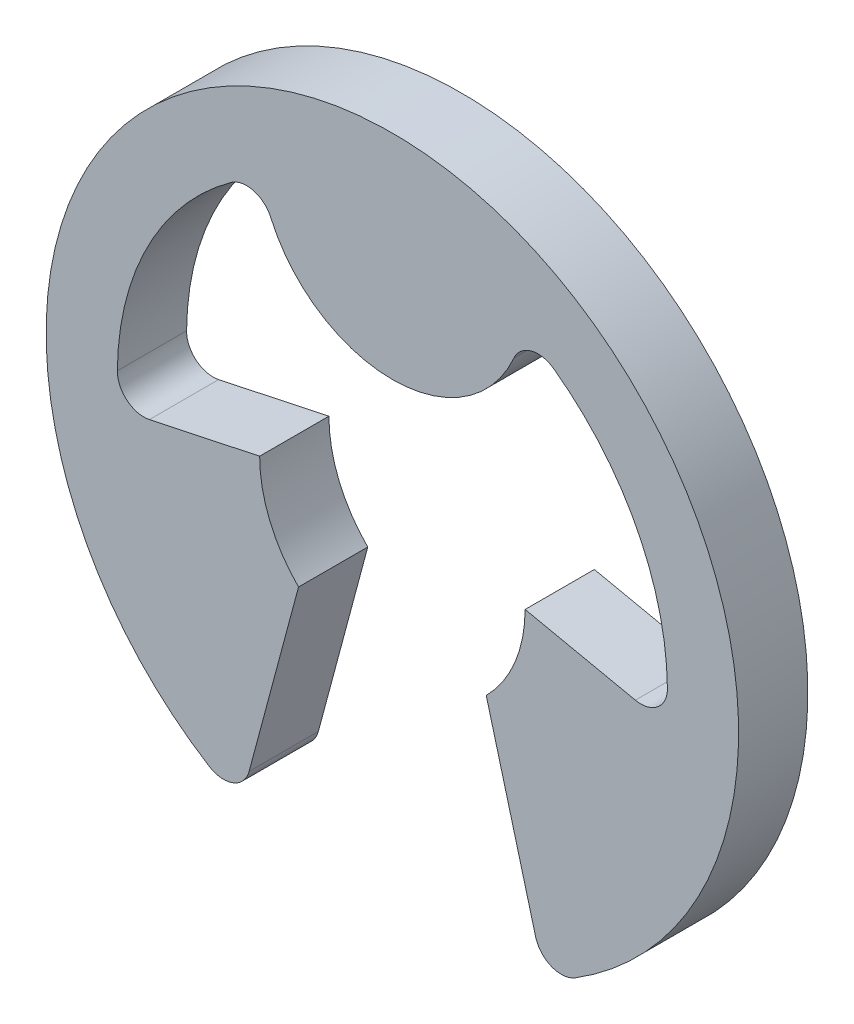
SolidWorks part; units mm, degrees
ref_plane "Face" through (0, 0, 0) normal (0, 0, 1) x (1, 0, 0)
ref_plane "Dessus" through (0, 0, 0) normal (0, 1, 0) x (1, 0, 0)
ref_plane "Droite" through (0, 0, 0) normal (1, 0, 0) x (0, 0, -1)
sketch "Esquisse1" plane through (0, 0, 0) normal (0, 0, 1) x (1, 0, 0)
  line L0 (0, 2.3) -> (0, -2.1213) construction
  line L1 (0.8132, -0.8132) -> (1.2414, -2.4113)
  line L2 (-2.1054, -0.2031) -> (-1.15, 0)
  line L3 (2.1054, -0.2031) -> (1.15, 0)
  line L5 (-0.8132, -0.8132) -> (-1.2414, -2.4113)
  line L6 (0, 0) -> (-3, 0) construction
  line L8 (0, 0) -> (-2.1213, -2.1213) construction
  arc A0 (-1.5851, -2.5471) -> (-1.2414, -2.4113) centre (-1.4636, -2.3518) ccw
  arc A1 (1.5851, -2.5471) -> (-1.5851, -2.5471) centre (0, 0) ccw
  arc A2 (-1.15, 0) -> (-0.8132, -0.8132) centre (0, 0) ccw
  arc A3 (-2.3832, 0.0242) -> (-2.1054, -0.2031) centre (-2.1532, 0.0219) ccw
  arc A4 (-1.3979, 1.9303) -> (-2.3832, 0.0242) centre (0, 0) ccw
  arc A5 (-1.0525, 1.8367) -> (-1.3979, 1.9303) centre (-1.263, 1.744) ccw
  arc A6 (1.0525, 1.8367) -> (1.3979, 1.9303) centre (1.263, 1.744) cw
  arc A7 (-1.0525, 1.8367) -> (1.0525, 1.8367) centre (0, 2.3) ccw
  arc A8 (1.3979, 1.9303) -> (2.3832, 0.0242) centre (0, 0) cw
  arc A9 (2.3832, 0.0242) -> (2.1054, -0.2031) centre (2.1532, 0.0219) cw
  arc A10 (1.15, 0) -> (0.8132, -0.8132) centre (0, 0) cw
  arc A11 (1.5851, -2.5471) -> (1.2414, -2.4113) centre (1.4636, -2.3518) cw
  dimension "D1" = 3
  dimension "D2" = 0.23
  dimension "Diamètre gorge" = 2.3
  dimension "D3" = 2.3833
  dimension "D5" = 15
  dimension "D7" = 1.15
  dimension "D6" = 12
  dimension "D4" = 45
extrude "Base-Extrusion" add sketch "Esquisse1" along normal blind 0.6
